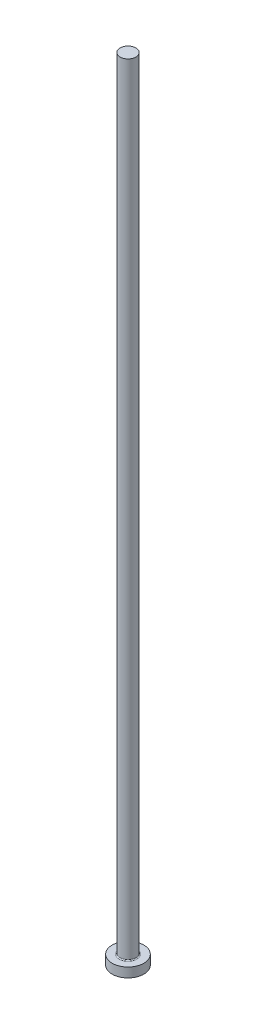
SolidWorks part; units mm, degrees
ref_plane "Plano frontal" through (0, 0, 0) normal (0, 0, 1) x (1, 0, 0)
ref_plane "Plano superior" through (0, 0, 0) normal (0, 1, 0) x (1, 0, 0)
ref_plane "Plano direito" through (0, 0, 0) normal (1, 0, 0) x (0, 0, -1)
sketch "Esboço1" plane through (0, 0, 0) normal (0, 0, 1) x (1, 0, 0)
  line L0 (0, 0) -> (5, 0)
  line L1 (5, 0) -> (5, 3)
  line L2 (5, 3) -> (2.8, 3)
  line L3 (2.5, 3.3) -> (2.5, 250)
  line L4 (2.5, 250) -> (0, 250)
  line L5 (0, 250) -> (0, 0) construction
  line L6 (0, 0) -> (0, 250)
  arc A0 (2.8, 3) -> (2.5, 3.3) centre (2.8, 3.3) cw
  dimension "D3" = 0.3
  dimension "D1" = 10
  dimension "D2" = 5
  dimension "D4" = 3
  dimension "D5" = 250
revolve "Revolução1" add sketch "Esboço1" angle 360 about L5
sketch "Esboço2"
  dimension "D1" = 0.375
  dimension "D2" = 0.875
  dimension "D3" = 0.5625
  dimension "D4" = 2.6875
wrap "Envolver1" sketch "Esboço2" wrap type deboss source sketch "Esboço2" thickness 0.1 parameters "D1"=0.1
